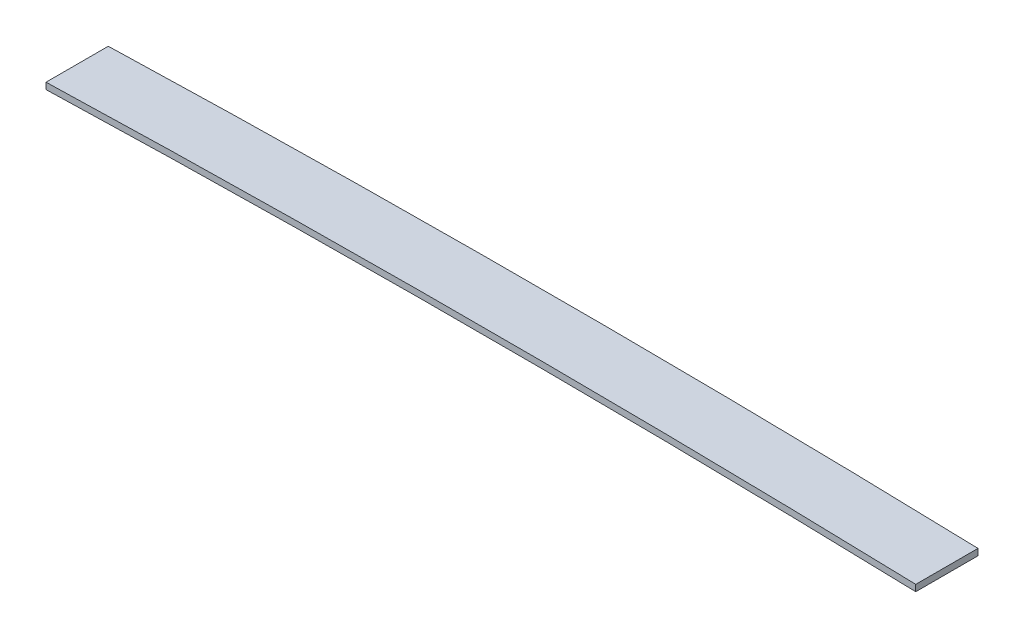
SolidWorks part; units mm, degrees
ref_plane "Плоскость1" through (0, 0, 0) normal (0, 0, 1) x (1, 0, 0)
ref_plane "Плоскость2" through (0, 0, 0) normal (0, 1, 0) x (1, 0, 0)
ref_plane "Плоскость3" through (0, 0, 0) normal (1, 0, 0) x (0, 0, -1)
sketch "Эскиз1" plane through (0, 0, 0) normal (0, 0, 1) x (1, 0, 0)
  line L0 (-440, 6.5) -> (440, 6.5) construction
  line L1 (-440, 0) -> (440, 0) construction
  line L2 (-440, 0) -> (-440, 13) construction
  line L3 (-440, 13) -> (440, 13) construction
  line L4 (440, 0) -> (440, 13) construction
  line L5 (-440, 6.5) -> (-440, 0)
  line L6 (440, 6.5) -> (440, 0)
  arc A0 (-440, 0) -> (440, 0) centre (0, -14889.0577) cw
  arc A1 (-440, 6.5) -> (440, 6.5) centre (0, -14882.5577) cw
  dimension "D1" = 880
  dimension "D2" = 13
  dimension "D3" = 6.5
extrude "Основание-Вытянуть" add sketch "Эскиз1" along normal mid plane 63
